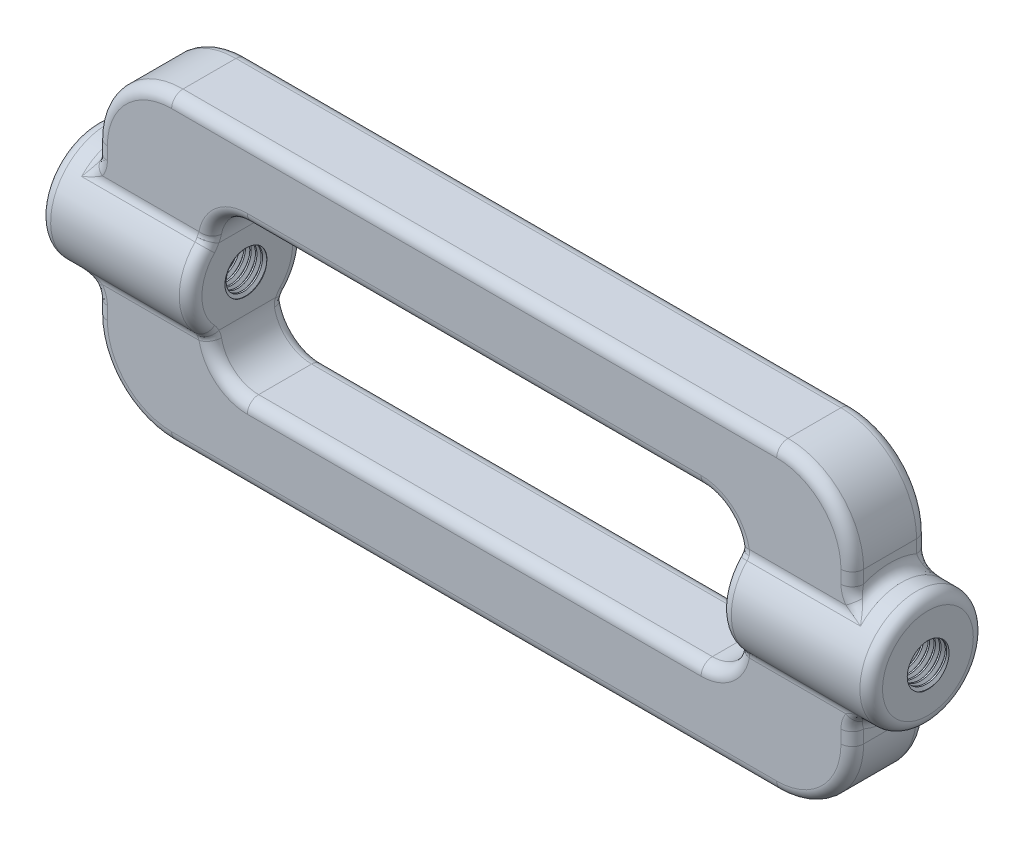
SolidWorks part; units mm, degrees
ref_plane "Plan de face" through (0, 0, 0) normal (0, 0, 1) x (1, 0, 0)
ref_plane "Plan de dessus" through (0, 0, 0) normal (0, 1, 0) x (1, 0, 0)
ref_plane "Plan de droite" through (0, 0, 0) normal (1, 0, 0) x (0, 0, -1)
sketch "Esquisse1" plane through (0, 0, 0) normal (0, 0, 1) x (1, 0, 0)
  line L13 (-100, 40) -> (100, 40)
  line L14 (-100, 40) -> (-100, -40)
  line L15 (-100, -40) -> (100, -40)
  line L16 (100, 40) -> (100, -40)
  dimension "D3" = 100
  dimension "D4" = 40
  dimension "D1" = 200
  dimension "D2" = 80
extrude "Boss.-Extru.1" add sketch "Esquisse1" along normal mid plane 20
fillet "Congé2" radius 20 4 edges at (100, -40, 0) (100, 40, 0) (-100, -40, 0) (-100, 40, 0)
sketch "Esquisse2" plane through (0, 0, 0) normal (1, 0, 0) x (0, 0, -1)
  circle A0 centre (0, 0) radius 15
  dimension "D1" = 30
extrude "Boss.-Extru.2" add sketch "Esquisse2" along normal mid plane 220
sketch "Esquisse3" plane through (0, 0, 0) normal (0, 0, 1) x (1, 0, 0)
  line L0 (80, 40) -> (-80, 40) construction
  line L1 (-70, 20) -> (70, 20)
  line L2 (-70, 20) -> (-70, -20)
  line L3 (-70, -20) -> (70, -20)
  line L4 (70, 20) -> (70, -20)
  line L5 (-100, -11.1803) -> (-100, -20) construction
  line L6 (100, -20) -> (100, -11.1803) construction
  dimension "D1" = 40
  dimension "D2" = 20
  dimension "D3" = 30
  dimension "D4" = 30
extrude "Enlèv. mat.-Extru.1" cut sketch "Esquisse3" against normal through all both and the other way through all
fillet "Congé3" radius 10 4 edges at (70, 20, 0) (70, -20, 0) (-70, -20, 0) (-70, 20, 0)
fillet "Congé5" radius 3 30 edges at (0, -20, 10) (0, 20, 10) (0, 20, -10) (0, -20, -10) (-66.6407, -17.4767, -10) (-66.6407, 17.4767, -10) (-66.6407, 17.4767, 10) (-66.6407, -17.4767, 10) (66.6407, -17.4767, 10) (66.6407, 17.4767, 10) (66.6407, 17.4767, -10) (66.6407, -17.4767, -10) (-100, 15, 0) (-100, -15, 0) (-84.965, -11.1803, -10) (-70, 0, 15) (-70, 0, -15) (-84.965, 11.1803, -10) (-84.965, 11.1803, 10) (-84.965, -11.1803, 10) (-110, 0, -15) (110, 0, -15) (100, 15, 0) (100, -15, 0) (84.965, -11.1803, 10) (70, 0, 15) (70, 0, -15) (84.965, 11.1803, 10) (84.965, 11.1803, -10) (84.965, -11.1803, -10)
fillet "Congé6" radius 3 36 edges at (101.7945, 11.3228, -10.2198) (100.2622, 13.4666, -10) (100, 17.4833, -10) (94.1421, 34.1421, -10) (-101.7945, 11.3228, -10.2198) (-100.1479, 13.8337, -10) (-100, 17.4833, -10) (-94.1421, 34.1421, -10) (-101.7945, -11.3228, -10.2198) (-100.2622, -13.4666, -10) (-100, -17.4833, -10) (-94.1421, -34.1421, -10) (101.7945, -11.3228, -10.2198) (100.1479, -13.8337, -10) (100, -17.4833, -10) (94.1421, -34.1421, -10) (-101.7945, -11.3228, 10.2198) (-100.1479, -13.8337, 10) (-100, -17.4833, 10) (-94.1421, -34.1421, 10) (101.7945, -11.3228, 10.2198) (100.2622, -13.4666, 10) (100, -17.4833, 10) (94.1421, -34.1421, 10) (101.7945, 11.3228, 10.2198) (100.1479, 13.8337, 10) (100, 17.4833, 10) (94.1421, 34.1421, 10) (-101.7945, 11.3228, 10.2198) (-100.2622, 13.4666, 10) (-100, 17.4833, 10) (-94.1421, 34.1421, 10) (0, 40, -10) (0, -40, -10) (0, -40, 10) (0, 40, 10)
sketch "Esquisse4" plane through (110, 0, 0) normal (1, 0, 0) x (0, 0, -1)
  circle A0 centre (0, 0) radius 6
  dimension "D1" = 12
extrude "Enlèv. mat.-Extru.2" cut sketch "Esquisse4" against normal through all
thread "Filetage1" pitch 1.5 start angle 0, offset 10, length 60, pitch 1.5, diameter 12
ref_plane "Plan1" through (120, 0, 6) normal (0, -1, 0) x (0, 0, 1)
sketch "Profil de filetage1" plane through (120, 0, 6) normal (0, -1, 0) x (0, 0, 1)
  line L0 (0, 0) -> (0, 1.5) construction
  line L11 (0, 0) -> (0, 1.3125)
  line L12 (0, 1.3125) -> (-0.8119, 0.8437)
  line L13 (-0.8119, 0.8437) -> (-0.8119, 0.4687)
  line L15 (-0.8119, 0.4687) -> (0, 0)
  line L17 (-0.8119, 0.6562) -> (0, 0.6562) construction
  point P2 (0, 0)
  dimension "Pitch" = 1.5
  dimension "Profile_Angle" = 60
  dimension "Profile_Land" = 0.375
  dimension "Profile_Height" = 0.8119
thread "Filetage2" start angle 0, offset 10, length 60, pitch 1.5, diameter 12
ref_plane "Plan2" through (-120, 0, -6) normal (0, -1, 0) x (0, 0, -1)
sketch "Profil de filetage2" plane through (-120, 0, -6) normal (0, -1, 0) x (0, 0, -1)
  line L0 (0, 0) -> (0, 1.5) construction
  line L11 (0, 0) -> (0, 1.3125)
  line L12 (0, 1.3125) -> (-0.8119, 0.8437)
  line L13 (-0.8119, 0.8437) -> (-0.8119, 0.4687)
  line L15 (-0.8119, 0.4687) -> (0, 0)
  line L17 (-0.8119, 0.6562) -> (0, 0.6562) construction
  point P2 (0, 0)
  dimension "Pitch" = 1.5
  dimension "Profile_Angle" = 60
  dimension "Profile_Land" = 0.375
  dimension "Profile_Height" = 0.8119
sketch "Esquisse10" plane through (0, 0, 0) normal (0, 0, 1) x (1, 0, 0)
  line L0 (-110, 12) -> (-110, -12) construction
  line L1 (-144.9431, 22.6619) -> (-110, 22.6619)
  line L2 (-144.9431, 22.6619) -> (-144.9431, -8.584)
  line L3 (-144.9431, -8.584) -> (-110, -8.584)
  line L4 (-110, 22.6619) -> (-110, -8.584)
  line L5 (-70, -8.2999) -> (-70, 8.2999) construction
  line L6 (-70, 7.0389) -> (70, 7.0389)
  line L7 (-70, 7.0389) -> (-70, -8.2999)
  line L8 (-70, -8.2999) -> (70, -8.2999)
  line L9 (70, 7.0389) -> (70, -8.2999)
  line L10 (70, 8.2999) -> (70, -8.2999) construction
  line L11 (110, -12) -> (110, 12) construction
  line L12 (133.6025, 8.2999) -> (110, 8.2999)
  line L13 (133.6025, 8.2999) -> (133.6025, -9.498)
  line L14 (133.6025, -9.498) -> (110, -9.498)
  line L15 (110, 8.2999) -> (110, -9.498)
extrude "Enlèv. mat.-Extru.3" cut sketch "Esquisse10" against normal through all both and the other way through all
